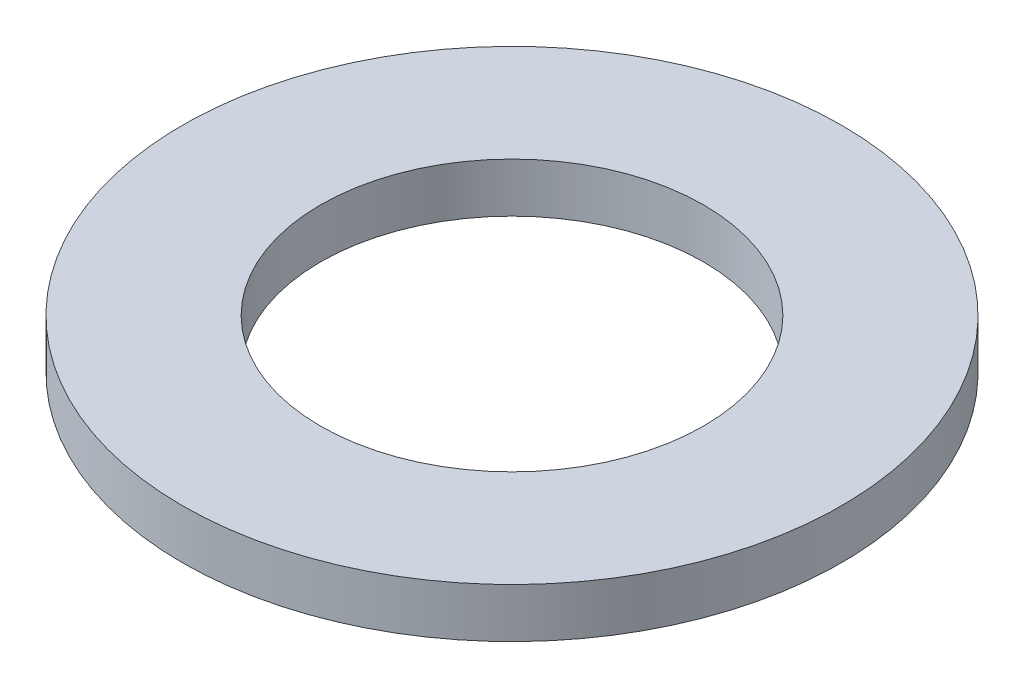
SolidWorks part; units mm, degrees
ref_plane "Front" through (0, 0, 0) normal (0, 0, 1) x (1, 0, 0)
ref_plane "Top" through (0, 0, 0) normal (0, 1, 0) x (1, 0, 0)
ref_plane "Right" through (0, 0, 0) normal (1, 0, 0) x (0, 0, -1)
sketch "Sketch1" plane through (0, 0, 0) normal (0, 1, 0) x (1, 0, 0)
  circle A0 centre (0, 0) radius 46.5
  circle A1 centre (0, 0) radius 80
extrude "Extrude1" add sketch "Sketch1" along normal blind 12
